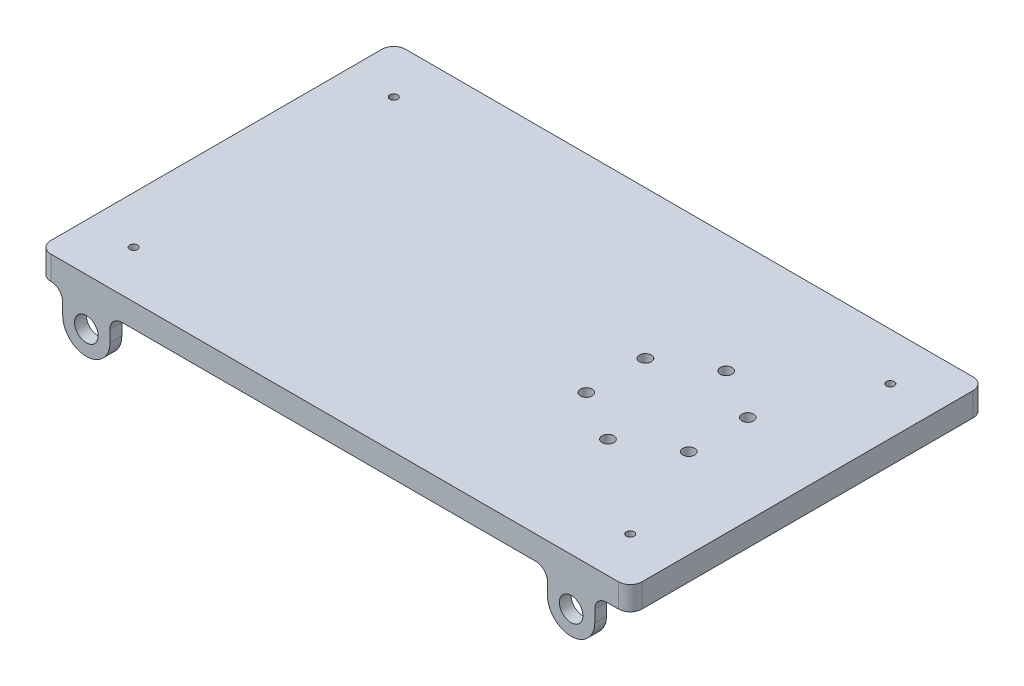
SolidWorks part; units mm, degrees
ref_plane "前视基准面" through (0, 0, 0) normal (0, 0, 1) x (1, 0, 0)
ref_plane "上视基准面" through (0, 0, 0) normal (0, 1, 0) x (1, 0, 0)
ref_plane "右视基准面" through (0, 0, 0) normal (1, 0, 0) x (0, 0, -1)
other "Configuration Table"
sketch "草图1" plane through (0, 0, 0) normal (0, 1, 0) x (1, 0, 0)
  line L1 (250, -150) -> (-250, -150)
  line L2 (250, -150) -> (250, 150)
  line L3 (250, 150) -> (-250, 150)
  line L4 (-250, -150) -> (-250, 150)
  line L5 (250, -150) -> (-250, 150) construction
  line L6 (250, 150) -> (-250, -150) construction
  point P0 (0, 0)
  dimension "D1" = 500
  dimension "D2" = 300
extrude "凸台-拉伸1" add sketch "草图1" along normal blind 20
sketch "草图2" plane through (0, 0, 150) normal (0, 0, 1) x (1, 0, 0)
  line L0 (180, 0) -> (180, -19.9739)
  line L1 (-250, 0) -> (250, 0) construction
  line L2 (180, -19.9739) -> (220, -19.9739)
  line L3 (220, -19.9739) -> (220, 0)
  line L4 (220, 0) -> (180, 0)
  line L5 (250, 20) -> (250, 0) construction
  line L6 (180, -19.9739) -> (220, -19.9739)
  arc A0 (180, -19.9739) -> (220, -19.9739) centre (200, -19.9739) ccw
  circle A1 centre (200, -19.9739) radius 10
  dimension "D3" = 20
  dimension "D1" = 40
  dimension "D2" = 30
extrude "凸台-拉伸2" add sketch "草图2" against normal blind 10 contours L2 L3 L0 M5 | L2 A0
fillet "圆角1" radius 10 4 edges at (-250, 10, 150) (-250, 10, -150) (250, 10, -150) (250, 10, 150)
fillet "圆角2" radius 10 2 edges at (180, 0, 145) (220, 0, 145)
pattern_linear "阵列(线性)2" count 2 spacing 290 along (0, 0, -1) of "凸台-拉伸2"
pattern_linear "阵列(线性)3" count 2 spacing 410 along (-1, 0, 0) of "凸台-拉伸2"
pattern_linear "阵列(线性)5" count 2 spacing 290 along (0, 0, -1) of "阵列(线性)3"
fillet "圆角3" radius 10 6 edges at (220, 0, -145) (180, 0, -145) (-230, 0, -145) (-190, 0, -145) (-190, 0, 145) (-230, 0, 145)
sketch "草图5" plane through (0, 20, 0) normal (0, 1, 0) x (1, 0, 0)
  circle A1 centre (131.1463, 50) radius 5
  circle A2 centre (174.4476, 25) radius 5
  circle A3 centre (174.4476, -25) radius 5
  circle A4 centre (131.1463, -50) radius 5
  circle A5 centre (87.8451, -25) radius 5
  circle A6 centre (87.8451, 25) radius 5
  point P0 (131.1463, 0)
  dimension "D1" = 6
  dimension "10" = 10
extrude "切除-拉伸1" cut sketch "草图5" against normal through all
sketch "草图6" plane through (0, 20, 0) normal (0, 1, 0) x (1, 0, 0)
  line L0 (-180, 0) -> (-125.4153, 0) construction
  line L1 (-180, 40) -> (-125.4153, 40)
  line L2 (-180, -40) -> (-125.4153, -40)
  line L3 (-250, 140) -> (-250, -140) construction
  arc A0 (-180, 40) -> (-180, -40) centre (-180, 0) ccw
  arc A1 (-125.4153, -40) -> (-125.4153, 40) centre (-125.4153, 0) ccw
  point P3 (-152.7076, 0)
  dimension "D1" = 70
  dimension "D2" = 80
extrude "凸台-拉伸3" add sketch "草图6" along normal blind 100
sketch "草图7" plane through (0, 120, 0) normal (0, 1, 0) x (1, 0, 0)
  line L0 (-125.4153, 40) -> (-180, 40) construction
  line L1 (-130.4153, -20) -> (-170.4153, -20)
  line L2 (-130.4153, -20) -> (-130.4153, 20)
  line L3 (-130.4153, 20) -> (-170.4153, 20)
  line L4 (-170.4153, -20) -> (-170.4153, 20)
  line L5 (-130.4153, -20) -> (-170.4153, 20) construction
  line L6 (-130.4153, 20) -> (-170.4153, -20) construction
  point P0 (-150.4153, 0)
  dimension "D1" = 40
  dimension "D2" = 40
  dimension "40" = 40
  dimension "D3" = 5
extrude "凸台-拉伸4" add sketch "草图7" along normal blind 80
chamfer "倒角1" distance 10 angle 45 4 edges at (-150.4153, 120, -20) (-130.4153, 120, 0) (-170.4153, 120, 0) (-150.4153, 120, 20)
sketch "草图8" plane through (0, 200, 0) normal (0, 1, 0) x (1, 0, 0)
  line L0 (-130.4153, 20) -> (-170.4153, 20) construction
  line L1 (-170.4153, 20) -> (-170.4153, -20) construction
  circle A0 centre (-164.4153, 14) radius 5
  circle A1 centre (-136.4153, 14) radius 5
  circle A2 centre (-136.4153, -14) radius 5
  circle A3 centre (-164.4153, -14) radius 5
  dimension "D1" = 10
  dimension "D2" = 6
  dimension "D3" = 6
  dimension "D4" = 2
  dimension "D5" = 2
extrude "凸台-拉伸5" add sketch "草图8" along normal blind 50
sketch "草图9" plane through (0, 250, 0) normal (0, 1, 0) x (1, 0, 0)
  line L1 (-170.4153, 20) -> (-130.4153, 20)
  line L2 (-170.4153, 20) -> (-170.4153, -20)
  line L3 (-170.4153, -20) -> (-130.4153, -20)
  line L4 (-130.4153, 20) -> (-130.4153, -20)
extrude "凸台-拉伸6" add sketch "草图9" along normal blind 10
fillet "圆角4" radius 3 4 edges at (-164.4153, 200, -9) (-136.4153, 200, -9) (-136.4153, 200, 19) (-164.4153, 200, 19)
sketch "草图10" plane through (0, 0, 0) normal (0, 0, 1) x (1, 0, 0)
  line L1 (-350, 20) -> (350, 20)
  line L2 (-350, 20) -> (-350, 600)
  line L3 (-350, 600) -> (350, 600)
  line L4 (350, 20) -> (350, 600)
  line L5 (-350, 20) -> (350, 600) construction
  line L6 (-350, 600) -> (350, 20) construction
  point P0 (0, 310)
  dimension "D1" = 350
  dimension "D2" = 20
  dimension "D3" = 310
extrude "Separate_At_Original_Deck_Y20" cut sketch "草图10" against normal mid plane 1000
sketch "草图11" plane through (0, 0, 0) normal (0, 1, 0) x (1, 0, 0)
  circle A0 centre (-210, -110) radius 3.3
  circle A1 centre (-210, 110) radius 3.3
  circle A2 centre (210, -110) radius 3.3
  circle A3 centre (210, 110) radius 3.3
  dimension "D1" = 6.6
  dimension "D2" = 210
  dimension "D3" = 210
  dimension "D4" = 110
  dimension "D5" = 110
extrude "Four_M6_Clearance_D6p6_420x220" cut sketch "草图11" against normal mid plane 100
